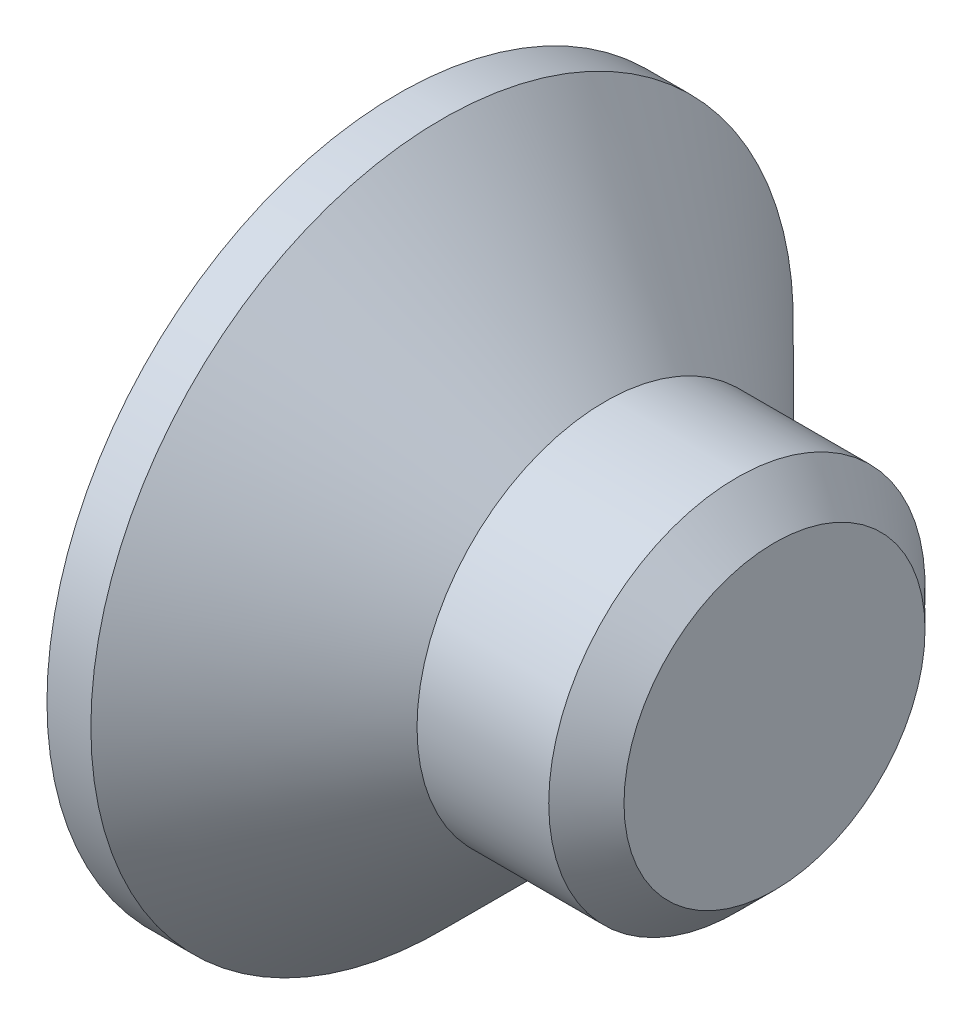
SolidWorks part; units mm, degrees
ref_plane "Front Plane" through (0, 0, 0) normal (0, 0, 1) x (1, 0, 0)
ref_plane "Top Plane" through (0, 0, 0) normal (0, 1, 0) x (1, 0, 0)
ref_plane "Right Plane" through (0, 0, 0) normal (1, 0, 0) x (0, 0, -1)
sketch "Sketch1" plane through (0, 0, 0) normal (0, 0, 1) x (1, 0, 0)
  line L1 (-1.65, 2.8) -> (-1.65, 0)
  line L2 (-1.65, 0) -> (1.35, 0)
  line L3 (1.35, 0) -> (1.35, 1.5)
  line L4 (1.35, 1.5) -> (0, 1.5)
  line L5 (-1.65, 2.8) -> (-1.3, 2.8)
  line L6 (-1.3, 2.8) -> (0, 1.5)
  dimension "D1" = 1.5
  dimension "D2" = 45
  dimension "D3" = 1.65
  dimension "D4" = 3
  dimension "D5" = 2.8
revolve "Revolve1" add sketch "Sketch1" angle 360 about L2
chamfer "Chamfer1" distance 0.3 angle 45 1 edges at (1.35, 0, 1.5)
sketch "Sketch2" plane through (-1.65, 0, 0) normal (-1, 0, 0) x (0, 0, 1)
  line L0 (-0.365, 1.45) -> (0.365, 1.45)
  line L1 (0.365, 1.45) -> (0.365, 0.365)
  line L2 (0.365, 0.365) -> (1.45, 0.365)
  line L3 (1.45, 0.365) -> (1.45, -0.365)
  line L4 (1.45, -0.365) -> (0.365, -0.365)
  line L5 (0.365, -0.365) -> (0.365, -1.45)
  line L6 (0.365, -1.45) -> (-0.365, -1.45)
  line L7 (-0.365, -1.45) -> (-0.365, -0.365)
  line L8 (-0.365, -0.365) -> (-1.45, -0.365)
  line L9 (-1.45, -0.365) -> (-1.45, 0.365)
  line L10 (-1.45, 0.365) -> (-0.365, 0.365)
  line L11 (-0.365, 0.365) -> (-0.365, 1.45)
  point P2 (0, 1.45)
  point P14 (0, -1.45)
  point P15 (1.45, 0)
  point P16 (-1.45, 0)
  point P17 (0.2443, 1.0495)
  point P18 (1.175, 0.2864)
  dimension "D1" = 2.9
  dimension "D2" = 0.73
extrude "Cut-Extrude1" cut sketch "Sketch2" against normal blind 1.25
